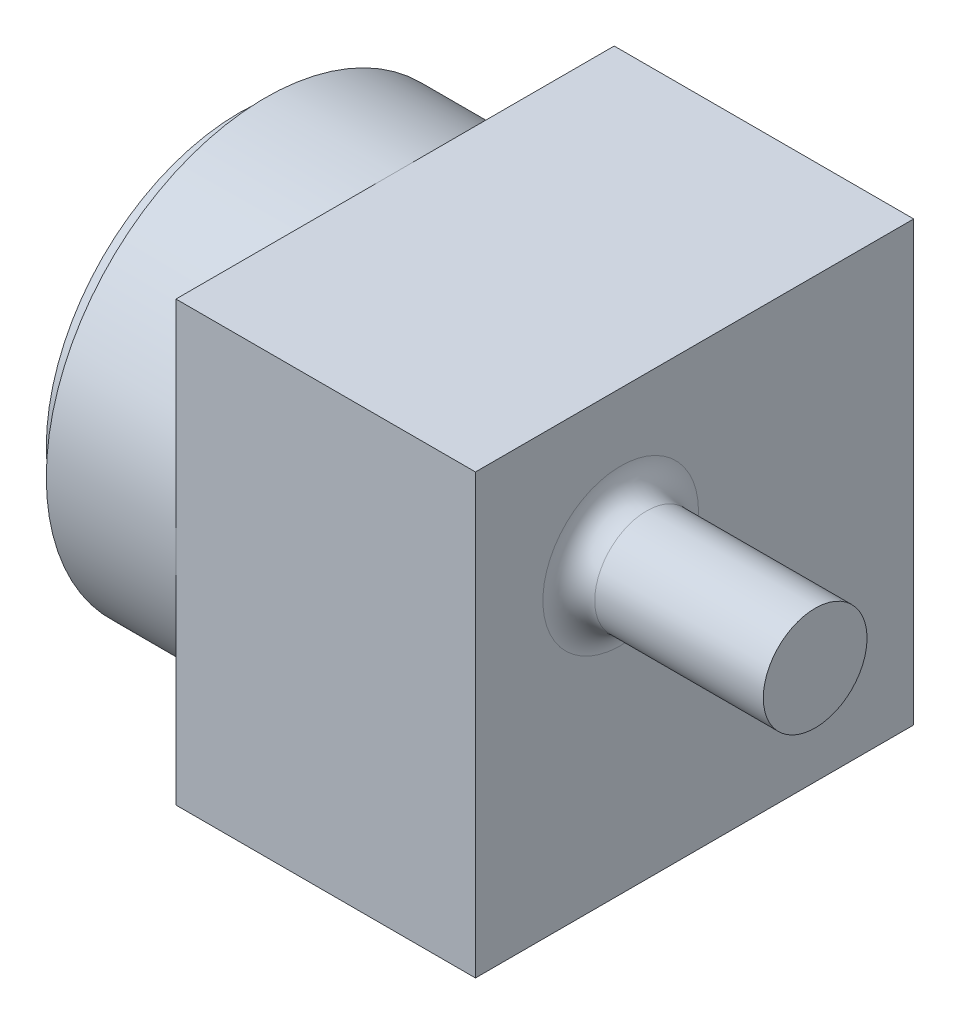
SolidWorks part; units mm, degrees
ref_plane "Front Plane" through (0, 0, 0) normal (0, 0, 1) x (1, 0, 0)
ref_plane "Top Plane" through (0, 0, 0) normal (0, 1, 0) x (1, 0, 0)
ref_plane "Right Plane" through (0, 0, 0) normal (1, 0, 0) x (0, 0, -1)
sketch "Sketch1" plane through (0, 0, 0) normal (1, 0, 0) x (0, 0, -1)
  line L0 (0, 0) -> (0, 8.5852) construction
  line L1 (-4.2926, 8.5852) -> (4.2926, 8.5852)
  line L2 (-4.2926, 8.5852) -> (-4.2926, 0)
  line L3 (-4.2926, 0) -> (4.2926, 0)
  line L4 (4.2926, 8.5852) -> (4.2926, 0)
  dimension "D1" = 8.5852
  dimension "D2" = 8.5852
extrude "main body" add sketch "Sketch1" along normal blind 5.8674
sketch "Sketch2" plane through (0, 0, 0) normal (-1, 0, 0) x (0, 0, 1)
  line L0 (-4.2926, 4.2926) -> (4.2926, 4.2926) construction
  line L1 (-4.2926, 0) -> (-4.2926, 8.5852) construction
  line L2 (4.2926, 8.5852) -> (4.2926, 0) construction
  circle A0 centre (0, 4.2926) radius 4.2926
extrude "lens base" add sketch "Sketch2" along normal blind 2.54
sketch "Sketch3" plane through (-2.54, 0, 0) normal (-1, 0, 0) x (0, 0, 1)
  circle A0 centre (0, 4.2926) radius 3.7846
  circle A1 centre (0, 4.2926) radius 4.2926 construction
  dimension "D1" = 0.508
extrude "lens screw" add sketch "Sketch3" along normal blind 0.508
sketch "Sketch4" plane through (-3.048, 0, 0) normal (-1, 0, 0) x (0, 0, 1)
  circle A0 centre (0, 4.2926) radius 2.6924
  dimension "D1" = 5.3848
extrude "iris" add sketch "Sketch4" along normal blind 0.8382 draft 45
sketch "Sketch5" plane through (-3.8862, 0, 0) normal (-1, 0, 0) x (0, 0, 1)
  circle A0 centre (0, 4.2926) radius 0.635
  dimension "D1" = 1.27
extrude "lens" cut sketch "Sketch5" against normal blind 0.254 draft 30
sketch "Sketch6" plane through (5.8674, 0, 0) normal (1, 0, 0) x (0, 0, -1)
  line L1 (4.2926, 8.5852) -> (-4.2926, 8.5852) construction
  line L2 (-4.2926, 8.5852) -> (-4.2926, 0) construction
  circle A0 centre (-1.4478, 5.7404) radius 1.016
  dimension "D1" = 2.032
  dimension "D2" = 2.8448
  dimension "D3" = 2.8448
extrude "wire" add sketch "Sketch6" along normal blind 3.81
fillet "wire fillet" radius 0.508 1 edges at (5.8674, 5.7404, 0.4318)
sketch "Sketch8" plane through (0, 8.5852, 0) normal (0, 1, 0) x (-1, 0, 0)
  line L0 (-5.8674, -4.2926) -> (-5.8674, 4.2926) construction
  point P0 (-5.8674, 0)
sketch "Sketch10" plane through (0, 0, 0) normal (0, 0, 1) x (1, 0, 0)
  line L0 (-3.8862, 4.2926) -> (5.8674, 4.2926) construction
  line L1 (-3.8862, 6.1468) -> (-3.8862, 2.4384) construction
  line L2 (5.8674, 8.5852) -> (5.8674, 0) construction
  dimension "D1" = 3.8862
  dimension "D2" = 9.7536
